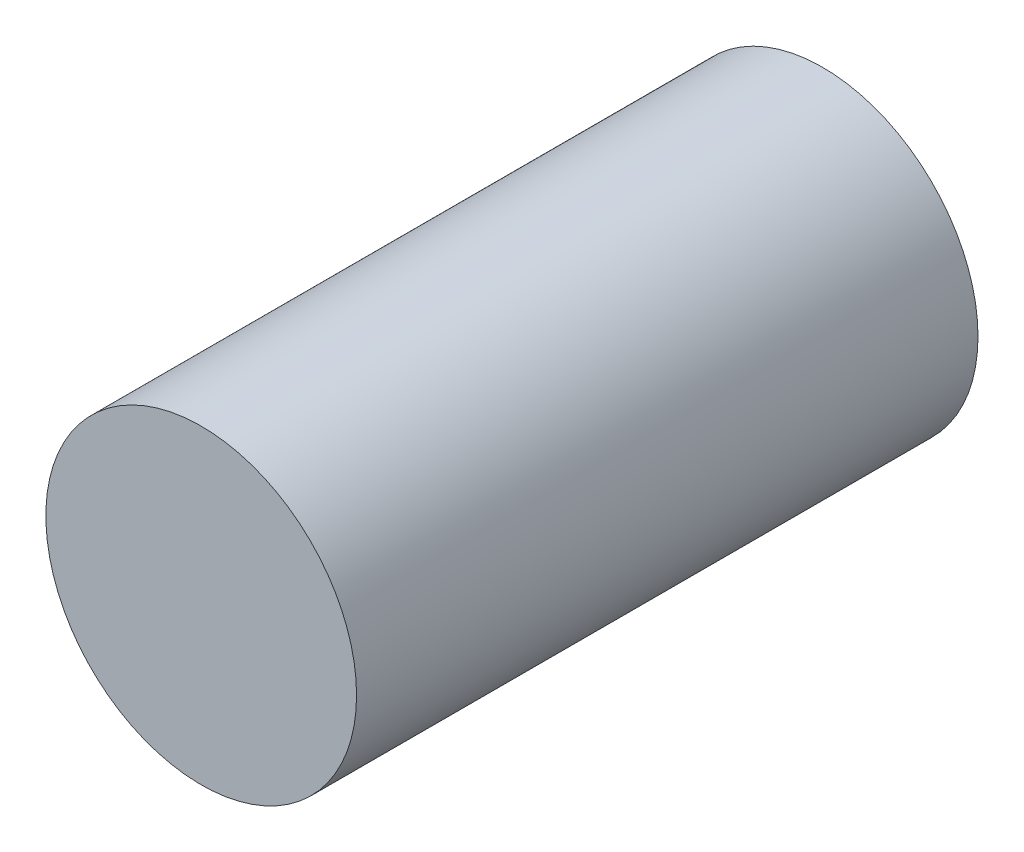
SolidWorks part; units mm, degrees
ref_plane "Plan1" through (0, 0, 0) normal (0, 0, 1) x (1, 0, 0)
ref_plane "Plan2" through (0, 0, 0) normal (0, 1, 0) x (1, 0, 0)
ref_plane "Plan3" through (0, 0, 0) normal (1, 0, 0) x (0, 0, -1)
sketch "Esquisse1" plane through (0, 0, 0) normal (0, 0, 1) x (1, 0, 0)
  circle A0 centre (0, 0) radius 12.5
extrude "Base-Extrusion" add sketch "Esquisse1" along normal blind 50
